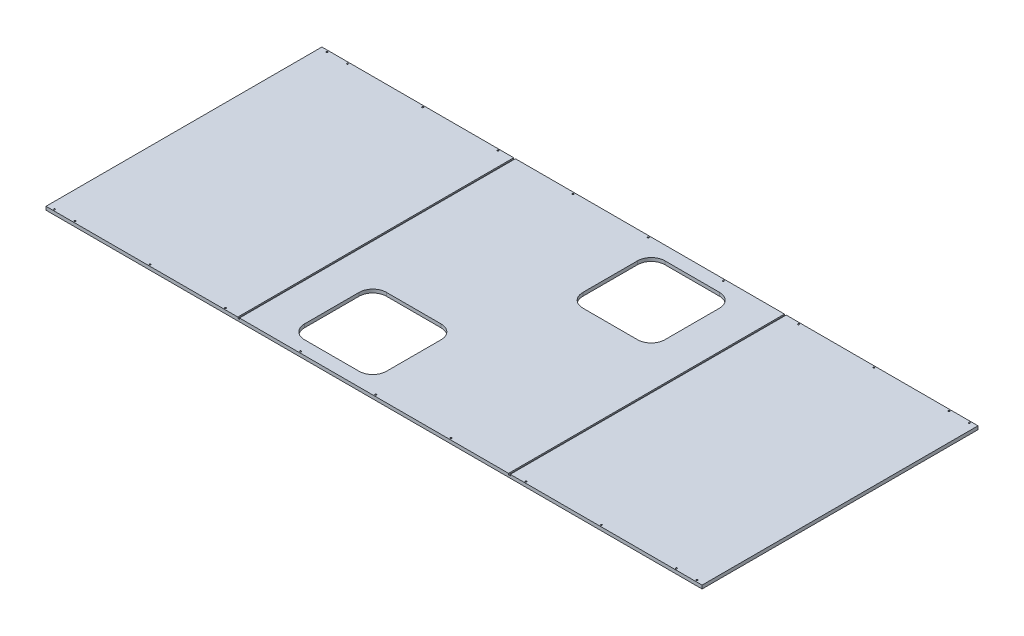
SolidWorks part; units mm, degrees
ref_plane "Front" through (0, 0, 0) normal (0, 0, 1) x (1, 0, 0)
ref_plane "Top" through (0, 0, 0) normal (0, 1, 0) x (1, 0, 0)
ref_plane "Right" through (0, 0, 0) normal (1, 0, 0) x (0, 0, -1)
sketch "Sketch1" plane through (0, 0, 0) normal (0, 1, 0) x (1, 0, 0)
  line L1 (0, 0) -> (1025.398, 0)
  line L3 (0, 1025.398) -> (1025.398, 1025.398)
  line L5 (0, 0) -> (-706.501, 0)
  line L7 (0, 1025.398) -> (-706.501, 1025.398)
  line L8 (-706.501, 0) -> (-706.501, 1025.398)
  line L9 (1025.398, 0) -> (1731.899, 0)
  line L11 (1025.398, 1025.398) -> (1731.899, 1025.398)
  line L12 (1731.899, 0) -> (1731.899, 1025.398)
  dimension "D1" = 1025.398
  dimension "D2" = 1025.398
  dimension "D3" = 706.501
  dimension "D4" = 706.501
extrude "Extrude1" add sketch "Sketch1" along normal blind 12.7
sketch "Sketch2" plane through (0, 12.7, 0) normal (0, 1, 0) x (1, 0, 0)
  line L1 (6.35, 1046.6115) -> (12.7, 1046.6115)
  line L2 (6.35, 1046.6115) -> (6.35, -27.5696)
  line L3 (6.35, -27.5696) -> (12.7, -27.5696)
  line L4 (12.7, 1046.6115) -> (12.7, -27.5696)
  line L5 (512.699, 0) -> (512.699, -39.4873) construction
  line L6 (-706.501, 0) -> (1731.899, 0) construction
  line L7 (1012.698, 1046.6115) -> (1012.698, -27.5696)
  line L8 (1019.048, -27.5696) -> (1012.698, -27.5696)
  line L9 (1019.048, 1046.6115) -> (1019.048, -27.5696)
  line L10 (1019.048, 1046.6115) -> (1012.698, 1046.6115)
  line L11 (-706.501, 1025.398) -> (-706.501, 0) construction
  dimension "D1" = 719.201
  dimension "D2" = 6.35
extrude "Cut-Extrude1" cut sketch "Sketch2" against normal blind 4.7625
sketch "Sketch3" plane through (0, 0, 0) normal (0, -1, 0) x (1, 0, 0)
  line L1 (618.998, -669.798) -> (822.198, -669.798)
  line L2 (568.198, -720.598) -> (568.198, -923.798)
  line L3 (618.998, -974.598) -> (822.198, -974.598)
  line L4 (872.998, -720.598) -> (872.998, -923.798)
  line L5 (1731.899, -1025.398) -> (-706.501, -1025.398) construction
  line L6 (-706.501, 0) -> (1731.899, 0) construction
  line L7 (203.2, -50.8) -> (406.4, -50.8)
  line L8 (152.4, -101.6) -> (152.4, -304.8)
  line L9 (203.2, -355.6) -> (406.4, -355.6)
  line L10 (457.2, -101.6) -> (457.2, -304.8)
  arc A0 (822.198, -669.798) -> (872.998, -720.598) centre (822.198, -720.598) cw
  arc A1 (618.998, -669.798) -> (568.198, -720.598) centre (618.998, -720.598) ccw
  arc A2 (568.198, -923.798) -> (618.998, -974.598) centre (618.998, -923.798) ccw
  arc A3 (822.198, -974.598) -> (872.998, -923.798) centre (822.198, -923.798) ccw
  arc A4 (406.4, -355.6) -> (457.2, -304.8) centre (406.4, -304.8) ccw
  arc A5 (152.4, -304.8) -> (203.2, -355.6) centre (203.2, -304.8) ccw
  arc A6 (406.4, -50.8) -> (457.2, -101.6) centre (406.4, -101.6) cw
  arc A7 (203.2, -50.8) -> (152.4, -101.6) centre (203.2, -101.6) ccw
  point P17 (872.998, -669.798)
  point P22 (568.198, -974.598)
  point P25 (872.998, -974.598)
  point P28 (457.2, -355.6)
  point P31 (152.4, -355.6)
  point P34 (457.2, -50.8)
  dimension "D9" = 50.8
  dimension "D1" = 304.8
  dimension "D2" = 304.8
  dimension "D4" = 50.8
  dimension "D5" = 304.8
  dimension "D6" = 304.8
  dimension "D7" = 50.8
extrude "Cut-Extrude2" cut sketch "Sketch3" against normal through all
sketch "Sketch4" plane through (0, 0, 0) normal (0, -1, 0) x (1, 0, 0)
  line L1 (1731.899, 0) -> (1731.899, -1025.398) construction
  line L2 (-706.501, 0) -> (1731.899, 0) construction
  line L5 (1731.899, -512.699) -> (1959.5011, -512.699) construction
  line L6 (512.699, 0) -> (512.699, -1025.398) construction
  line L7 (1731.899, -1025.398) -> (-706.501, -1025.398) construction
  circle A0 centre (1630.299, -6.35) radius 2.8067
  circle A1 centre (1706.499, -1019.048) radius 2.8067
  circle A2 centre (512.699, -1019.048) radius 2.8067
  circle A3 centre (792.099, -1019.048) radius 2.8067
  circle A4 centre (1350.899, -6.35) radius 2.8067
  circle A5 centre (1071.499, -6.35) radius 2.8067
  circle A6 centre (-604.901, -6.35) radius 2.8067
  circle A7 centre (-325.501, -6.35) radius 2.8067
  circle A8 centre (-46.101, -6.35) radius 2.8067
  circle A9 centre (233.299, -6.35) radius 2.8067
  circle A10 centre (-681.101, -6.35) radius 2.8067
  circle A11 centre (792.099, -6.35) radius 2.8067
  circle A12 centre (-681.101, -1019.048) radius 2.8067
  circle A13 centre (233.299, -1019.048) radius 2.8067
  circle A14 centre (-46.101, -1019.048) radius 2.8067
  circle A15 centre (-325.501, -1019.048) radius 2.8067
  circle A16 centre (-604.901, -1019.048) radius 2.8067
  circle A17 centre (1071.499, -1019.048) radius 2.8067
  circle A18 centre (512.699, -6.35) radius 2.8067
  circle A19 centre (1706.499, -6.35) radius 2.8067
  circle A20 centre (1350.899, -1019.048) radius 2.8067
  circle A21 centre (1630.299, -1019.048) radius 2.8067
  point P6 (1609.8012, -12.7)
  point P52 (1609.8012, -1012.698)
  dimension "D2" = 279.4
  dimension "D3" = 279.4
  dimension "D4" = 279.4
  dimension "D5" = 279.4
  dimension "D6" = 279.4
  dimension "D7" = 279.4
  dimension "D8" = 279.4
  dimension "D9" = 25.4
  dimension "D1" = 279.4
extrude "Extrude2" cut sketch "Sketch4" against normal through all
